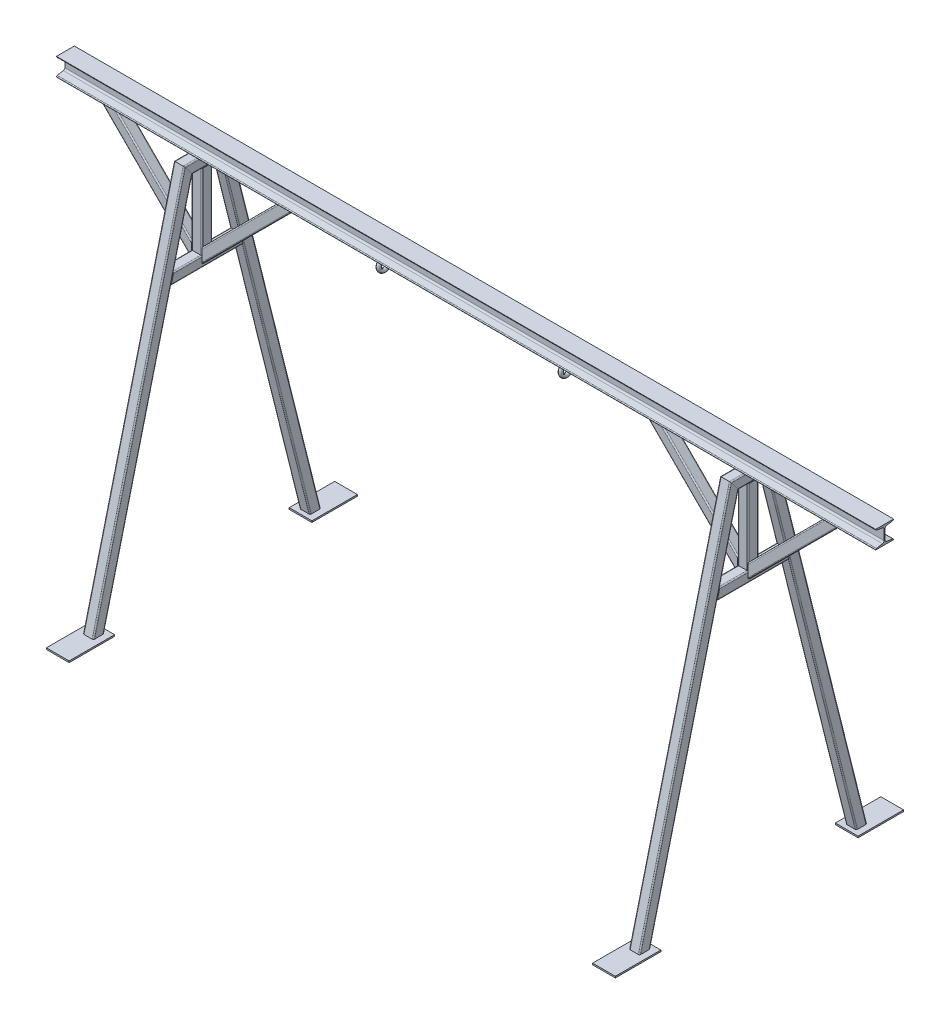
SolidWorks part; units mm, degrees
other "<Welded Ring>-<Fillet2>"
ref_plane "Front Plane" through (0, 0, 0) normal (0, 0, 1) x (1, 0, 0)
ref_plane "Top Plane" through (0, 0, 0) normal (0, 1, 0) x (1, 0, 0)
ref_plane "Right Plane" through (0, 0, 0) normal (1, 0, 0) x (0, 0, -1)
sketch "FootPrint" plane through (0, 0, 0) normal (0, 1, 0) x (1, 0, 0)
  line L1 (-1828.8, -762) -> (1828.8, -762) construction
  line L2 (-1828.8, -762) -> (-1828.8, 762) construction
  line L3 (-1828.8, 762) -> (1828.8, 762) construction
  line L4 (1828.8, -762) -> (1828.8, 762) construction
  line L5 (-1828.8, -762) -> (1828.8, 762) construction
  line L6 (-1828.8, 762) -> (1828.8, -762) construction
  point P0 (0, 0)
  dimension "D1" = 3657.6
  dimension "D2" = 1524
ref_plane "Plane1" through (-1828.8, 0, 0) normal (1, 0, 0) x (0, 0, -1)
sketch "Side Layout" plane through (-1828.8, 0, 0) normal (1, 0, 0) x (0, 0, -1)
  line L0 (0, 0) -> (0, 2438.4) construction
  line L1 (-762, 0) -> (762, 0) construction
  line L2 (-762, 0) -> (-152.4, 2438.4)
  line L3 (-152.4, 2438.4) -> (152.4, 2438.4)
  line L4 (-304.8, 1828.8) -> (304.8, 1828.8)
  line L5 (0, 2438.4) -> (0, 1828.8)
  line L6 (762, 0) -> (152.4, 2438.4)
  dimension "D1" = 2438.4
  dimension "D2" = 609.6
  dimension "D3" = 304.8
sketch "Top Bar Layout" plane through (0, 0, 0) normal (0, 0, 1) x (1, 0, 0)
  line L0 (-2743.2, 2438.4) -> (2743.2, 2438.4)
  line L1 (0, 0) -> (0, 2438.4) construction
  line L2 (-2438.4, 2438.4) -> (-1828.8, 1828.8)
  line L3 (-1828.8, 2438.4) -> (-1828.8, 1828.8) construction
  dimension "D1" = 5486.4
  dimension "D2" = 45
other "Tube (square) 70 X 70 X 4.0(1)"
ref_plane "Plane2" through (-1828.8, -8.4887, 728.045) normal (0, 0.9701, -0.2425) x (0, 0.2425, 0.9701)
sketch "Sketch1" plane through (-1828.8, -8.4887, 728.045) normal (0, 0.9701, -0.2425) x (0, 0.2425, 0.9701)
  line L0 (-27, -31) -> (27, -31)
  line L1 (-31, -27) -> (-31, 27)
  line L2 (27, 31) -> (-27, 31)
  line L3 (31, 27) -> (31, -27)
  line L4 (-27, -35) -> (27, -35)
  line L5 (-35, -27) -> (-35, 27)
  line L6 (27, 35) -> (-27, 35)
  line L7 (35, 27) -> (35, -27)
  line L8 (-35, 0) -> (-31, 0) construction
  line L9 (-31, 0) -> (31, 0) construction
  line L10 (31, 0) -> (35, 0) construction
  line L12 (0, 35) -> (0, 31) construction
  line L13 (0, 31) -> (0, -31) construction
  line L14 (0, -31) -> (0, -35) construction
  arc A0 (35, 27) -> (27, 35) centre (27, 27) ccw
  arc A1 (27, -35) -> (35, -27) centre (27, -27) ccw
  arc A2 (-35, -27) -> (-27, -35) centre (-27, -27) ccw
  arc A3 (-27, 35) -> (-35, 27) centre (-27, 27) ccw
  arc A4 (-27, 31) -> (-31, 27) centre (-27, 27) ccw
  arc A5 (31, 27) -> (27, 31) centre (27, 27) ccw
  arc A6 (27, -31) -> (31, -27) centre (27, -27) ccw
  arc A7 (-31, -27) -> (-27, -31) centre (-27, -27) ccw
  point P2 (-35, 35)
  point P33 (-35, -35)
  point P34 (35, -35)
  point P36 (35, 35)
  point P37 (0, 0)
  dimension "D1" = 8
  dimension "Thickness" = 4
  dimension "V_leg" = 70
  dimension "H_leg" = 70
mirror "Mirror1" about plane through (-1828.8, 0, 0) normal (1, 0, 0)
mirror "Mirror2" about plane through (0, 0, 0) normal (1, 0, 0)
other "Sc beam SC 120(1)"
ref_plane "Plane3" through (-2743.2, 2438.4, 0) normal (1, 0, 0) x (0, 1, 0)
sketch "Sketch11" plane through (-2743.2, 2438.4, 0) normal (1, 0, 0) x (0, 1, 0)
  line L0 (-60, -60) -> (-60, -58.8122)
  line L1 (-54.9865, -52.8939) -> (-13.2771, -45.9418)
  line L2 (-3.25, -34.1051) -> (-3.25, 34.1051)
  line L3 (-13.2771, 45.9418) -> (-54.9865, 52.8939)
  line L4 (-60, 58.8122) -> (-60, 60)
  line L5 (-60, 60) -> (60, 60)
  line L6 (60, 60) -> (60, 58.8122)
  line L7 (54.9865, 52.8939) -> (13.2771, 45.9418)
  line L8 (3.25, 34.1051) -> (3.25, -34.1051)
  line L9 (13.2771, -45.9418) -> (54.9865, -52.8939)
  line L10 (60, -58.8122) -> (60, -60)
  line L11 (60, -60) -> (-60, -60)
  line L14 (60, -49) -> (0, -49) construction
  line L15 (0, 60) -> (0, -60) construction
  line L16 (-3.25, 0) -> (3.25, 0) construction
  arc A0 (-13.2771, -45.9418) -> (-3.25, -34.1051) centre (-15.25, -34.1051) ccw
  arc A1 (-3.25, 34.1051) -> (-13.2771, 45.9418) centre (-15.25, 34.1051) ccw
  arc A2 (13.2771, 45.9418) -> (3.25, 34.1051) centre (15.25, 34.1051) ccw
  arc A3 (3.25, -34.1051) -> (13.2771, -45.9418) centre (15.25, -34.1051) ccw
  arc A4 (60, -58.8122) -> (54.9865, -52.8939) centre (54, -58.8122) ccw
  arc A5 (-60, -58.8122) -> (-54.9865, -52.8939) centre (-54, -58.8122) cw
  arc A6 (-54.9865, 52.8939) -> (-60, 58.8122) centre (-54, 58.8122) cw
  arc A7 (54.9865, 52.8939) -> (60, 58.8122) centre (54, 58.8122) ccw
  point P35 (0, 0)
  dimension "D7" = 9.463
  dimension "RI" = 12
  dimension "RA" = 6
  dimension "BF" = 120
  dimension "D6" = 9.463
  dimension "DEPTH" = 120
  dimension "TW" = 6.5
  dimension "D1" = 68.2102
  dimension "TF" = 11
other "Trim/Extend1"
sketch "Sketch12" plane through (0, 0, 0) normal (0, 1, 0) x (1, 0, 0)
  line L0 (-1828.8, -762) -> (-1828.8, -965.2) construction
  line L1 (-1905, -660.4) -> (-1752.6, -660.4)
  line L2 (-1905, -660.4) -> (-1905, -965.2)
  line L3 (-1905, -965.2) -> (-1752.6, -965.2)
  line L4 (-1752.6, -660.4) -> (-1752.6, -965.2)
  dimension "D1" = 203.2
  dimension "D2" = 152.4
  dimension "D3" = 304.8
extrude "Foot Plate" add sketch "Sketch12" against normal blind 10 separate body
mirror "Mirror3" about plane through (0, 0, 0) normal (1, 0, 0)
mirror "Mirror4" about plane through (0, 0, 0) normal (0, 0, 1)
other "Trim/Extend2"
ref_plane "Front Plane-Welded Ring" through (-609.6, 2438.4, 0) normal (1, 0, 0) x (0, 0, 1)
ref_plane "Top Plane-Welded Ring" through (-609.6, 2438.4, 0) normal (0, -1, 0) x (0, 0, 1)
ref_plane "Right Plane-Welded Ring" through (-609.6, 2438.4, 0) normal (0, 0, 1) x (-1, 0, 0)
inserted part "Welded Ring" parameters "D1"=0, "D2"=0, "D3"=0
move or copy body "Body-Move/Copy4"
other "Distance3" parameters "D1"=609.6
mirror "Mirror5" about plane through (0, 0, 0) normal (1, 0, 0)
